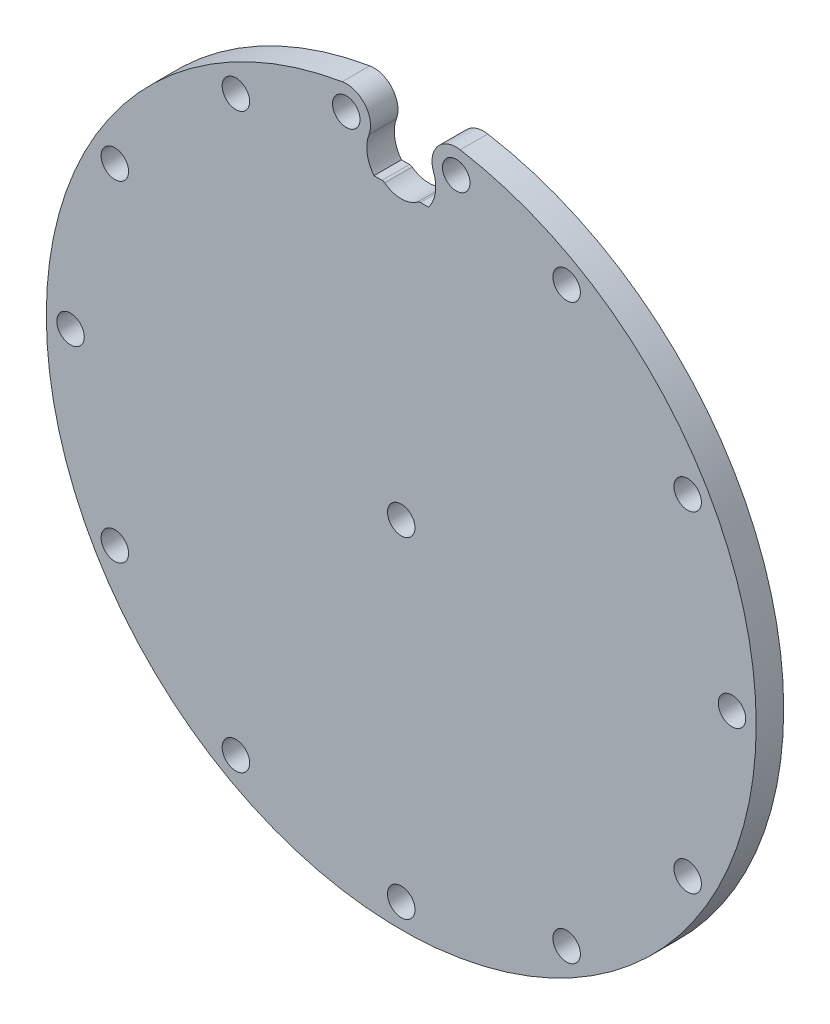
SolidWorks part; units mm, degrees
ref_plane "Front Plane" through (0, 0, 0) normal (0, 0, 1) x (1, 0, 0)
ref_plane "Top Plane" through (0, 0, 0) normal (0, 1, 0) x (1, 0, 0)
ref_plane "Right Plane" through (0, 0, 0) normal (1, 0, 0) x (0, 0, -1)
sketch "Sketch1" plane through (0, 0, 0) normal (0, 0, 1) x (1, 0, 0)
sketch_block_instance "pulley_block_double_cinch-1"
sketch_block "pulley_block_double_cinch"
sketch "Sketch2" plane through (0, 0, 0) normal (0, 0, 1) x (1, 0, 0)
  line L0 (2.0435, 32.8624) -> (3.1521, 32.8624) construction
  line L1 (-2.0435, 32.8624) -> (-3.1521, 32.8624) construction
  line L2 (2.0435, 32.8624) -> (3.1521, 32.8624)
  line L3 (-2.0435, 32.8624) -> (-3.1521, 32.8624)
  arc A0 (-4.9156, 40.0732) -> (-6.8154, 40.4296) centre (-6.35, 37.6685) ccw construction
  arc A1 (-4.9156, 40.0732) -> (-6.8154, 40.4296) centre (-6.35, 37.6685) ccw
  circle A3 centre (0, 0) radius 1.5875 construction
  circle A4 centre (-38.2, 0) radius 1.5875 construction
  circle A5 centre (-33.0822, -19.1) radius 1.5875 construction
  circle A6 centre (-19.1, -33.0822) radius 1.5875 construction
  circle A7 centre (0, -38.2) radius 1.5875 construction
  circle A8 centre (19.1, -33.0822) radius 1.5875 construction
  circle A9 centre (33.0822, -19.1) radius 1.5875 construction
  circle A10 centre (38.2, 0) radius 1.5875 construction
  circle A11 centre (-33.0822, 19.1) radius 1.5875 construction
  circle A12 centre (-19.1, 33.0822) radius 1.5875 construction
  circle A13 centre (33.0822, 19.1) radius 1.5875 construction
  circle A14 centre (19.1, 33.0822) radius 1.5875 construction
  circle A15 centre (6.35, 37.6685) radius 1.5875 construction
  circle A16 centre (-6.35, 37.6685) radius 1.5875 construction
  arc A17 (-6.8154, 40.4296) -> (6.8154, 40.4296) centre (0, 0) ccw construction
  arc A18 (6.8154, 40.4296) -> (4.9156, 40.0732) centre (6.35, 37.6685) ccw construction
  arc A19 (4.9156, 40.0732) -> (3.7276, 36.6872) centre (6.35, 37.6685) ccw construction
  arc A20 (3.1521, 32.8624) -> (3.7276, 36.6872) centre (0, 35.2924) ccw construction
  arc A21 (-2.0435, 32.8624) -> (2.0435, 32.8624) centre (0, 35.2924) ccw construction
  arc A22 (-3.7276, 36.6872) -> (-3.1521, 32.8624) centre (0, 35.2924) ccw construction
  arc A23 (-3.7276, 36.6872) -> (-4.9156, 40.0732) centre (-6.35, 37.6685) ccw construction
  circle A25 centre (0, 0) radius 1.5875
  circle A26 centre (-38.2, 0) radius 1.5875
  circle A27 centre (-33.0822, -19.1) radius 1.5875
  circle A28 centre (-19.1, -33.0822) radius 1.5875
  circle A29 centre (0, -38.2) radius 1.5875
  circle A30 centre (19.1, -33.0822) radius 1.5875
  circle A31 centre (33.0822, -19.1) radius 1.5875
  circle A32 centre (38.2, 0) radius 1.5875
  circle A33 centre (-33.0822, 19.1) radius 1.5875
  circle A34 centre (-19.1, 33.0822) radius 1.5875
  circle A35 centre (33.0822, 19.1) radius 1.5875
  circle A36 centre (19.1, 33.0822) radius 1.5875
  circle A37 centre (6.35, 37.6685) radius 1.5875
  circle A38 centre (-6.35, 37.6685) radius 1.5875
  arc A39 (-6.8154, 40.4296) -> (6.8154, 40.4296) centre (0, 0) ccw
  arc A40 (6.8154, 40.4296) -> (4.9156, 40.0732) centre (6.35, 37.6685) ccw
  arc A41 (4.9156, 40.0732) -> (3.7276, 36.6872) centre (6.35, 37.6685) ccw
  arc A42 (3.1521, 32.8624) -> (3.7276, 36.6872) centre (0, 35.2924) ccw
  arc A43 (-2.0435, 32.8624) -> (2.0435, 32.8624) centre (0, 35.2924) ccw
  arc A44 (-3.7276, 36.6872) -> (-3.1521, 32.8624) centre (0, 35.2924) ccw
  arc A45 (-3.7276, 36.6872) -> (-4.9156, 40.0732) centre (-6.35, 37.6685) ccw
extrude "Boss-Extrude1" add sketch "Sketch2" along normal blind 3.175
fillet "Fillet1" radius 0.5 2 edges at (2.0435, 32.8624, 1.5875) (-2.0435, 32.8624, 1.5875)
other "Move Face1" [suppressed] parameters "D1"=0.0762
other "Move Face2" [suppressed] parameters "D1"=0.2
equation "\"D22@pulley_block_double_cinch\" = \"D3@pulley_block_double_cinch\""
equation "\"D12@pulley_block_double_cinch\" = \"D1@pulley_block_double_cinch\""
equation "\"D25@pulley_block_double_cinch\" =  - \"D21@pulley_block_double_cinch\""
